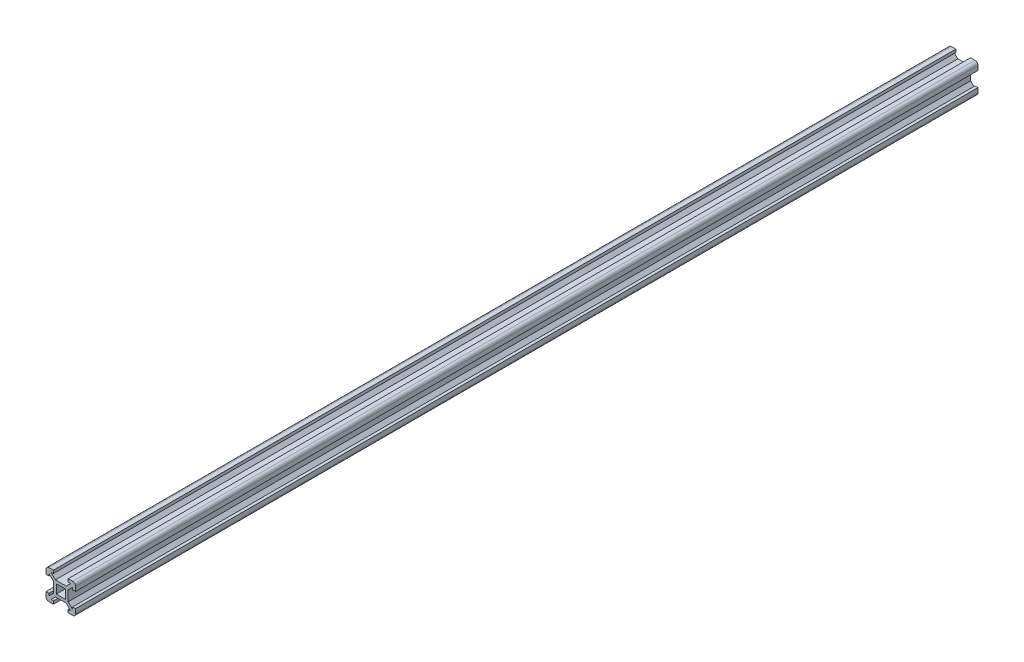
SolidWorks part; units mm, degrees
ref_plane "Plan de face" through (0, 0, 0) normal (0, 0, 1) x (1, 0, 0)
ref_plane "Plan de dessus" through (0, 0, 0) normal (0, 1, 0) x (1, 0, 0)
ref_plane "Plan de droite" through (0, 0, 0) normal (1, 0, 0) x (0, 0, -1)
sketch "Esquisse1" plane through (0, 0, 0) normal (0, 0, 1) x (1, 0, 0)
  line L0 (20, 10) -> (0, 10) construction
  line L1 (5, 13.5227) -> (5, 6.4773)
  line L2 (15, 15) -> (10, 10) construction
  line L3 (2, 20) -> (5, 20)
  line L4 (6.3502, 15) -> (3.3055, 18)
  line L5 (10, 20) -> (10, 0) construction
  line L6 (20, 15) -> (20, 18)
  line L7 (20, 15) -> (18, 15)
  line L8 (15, 20) -> (15, 18)
  line L9 (6.3502, 15) -> (13.6498, 15)
  line L10 (5, 5) -> (10, 10) construction
  line L11 (18, 16.4786) -> (18, 15)
  line L12 (5, 15) -> (10, 10) construction
  line L13 (3.3055, 18) -> (5, 18)
  line L14 (2, 16.4786) -> (2, 15)
  line L15 (16.6945, 18) -> (15, 18)
  line L16 (15, 5) -> (10, 10) construction
  line L17 (13.6498, 15) -> (16.6945, 18)
  line L18 (18, 20) -> (15, 20)
  line L19 (15, 13.5227) -> (15, 6.4773)
  line L21 (5, 13.5227) -> (2, 16.4786)
  line L22 (0, 5) -> (0, 2)
  line L23 (0, 5) -> (2, 5)
  line L24 (5, 0) -> (5, 2)
  line L25 (5, 6.4773) -> (2, 3.5214)
  line L26 (15, 6.4773) -> (18, 3.5214)
  line L27 (18, 0) -> (15, 0)
  line L28 (13.6498, 5) -> (16.6945, 2)
  line L29 (16.6945, 2) -> (15, 2)
  line L30 (5, 20) -> (5, 18)
  line L31 (2, 3.5214) -> (2, 5)
  line L32 (0, 15) -> (2, 15)
  line L33 (3.3055, 2) -> (5, 2)
  line L34 (18, 3.5214) -> (18, 5)
  line L35 (6.3502, 5) -> (13.6498, 5)
  line L36 (15, 0) -> (15, 2)
  line L37 (20, 5) -> (18, 5)
  line L38 (20, 5) -> (20, 2)
  line L39 (6.3502, 5) -> (3.3055, 2)
  line L40 (0, 15) -> (0, 18)
  line L41 (2, 0) -> (5, 0)
  line L42 (15, 13.5227) -> (18, 16.4786)
  line L43 (6.9573, 13.0427) -> (13.0427, 13.0427)
  line L44 (6.9573, 13.0427) -> (6.9573, 6.9573)
  line L45 (6.9573, 6.9573) -> (13.0427, 6.9573)
  line L46 (13.0427, 13.0427) -> (13.0427, 6.9573)
  line L47 (6.9573, 13.0427) -> (13.0427, 6.9573) construction
  line L48 (6.9573, 6.9573) -> (13.0427, 13.0427) construction
  arc A0 (0, 18) -> (2, 20) centre (2, 18) cw
  arc A1 (20, 18) -> (18, 20) centre (18, 18) ccw
  arc A2 (18, 0) -> (20, 2) centre (18, 2) ccw
  arc A3 (0, 2) -> (2, 0) centre (2, 2) ccw
  point P1 (10, 5)
  point P9 (10, 10)
  point P14 (10, 10)
  point P20 (10, 10)
  point P21 (10, 10)
  point P23 (10, 15)
  point P30 (0, 20)
  point P44 (15, 10)
  point P56 (5, 10)
  point P61 (-3.9158, 3.5214)
  point P63 (20, 20)
  point P66 (20, 0)
  point P69 (0, 0)
extrude "Extrusion1" add sketch "Esquisse1" along normal blind 610
